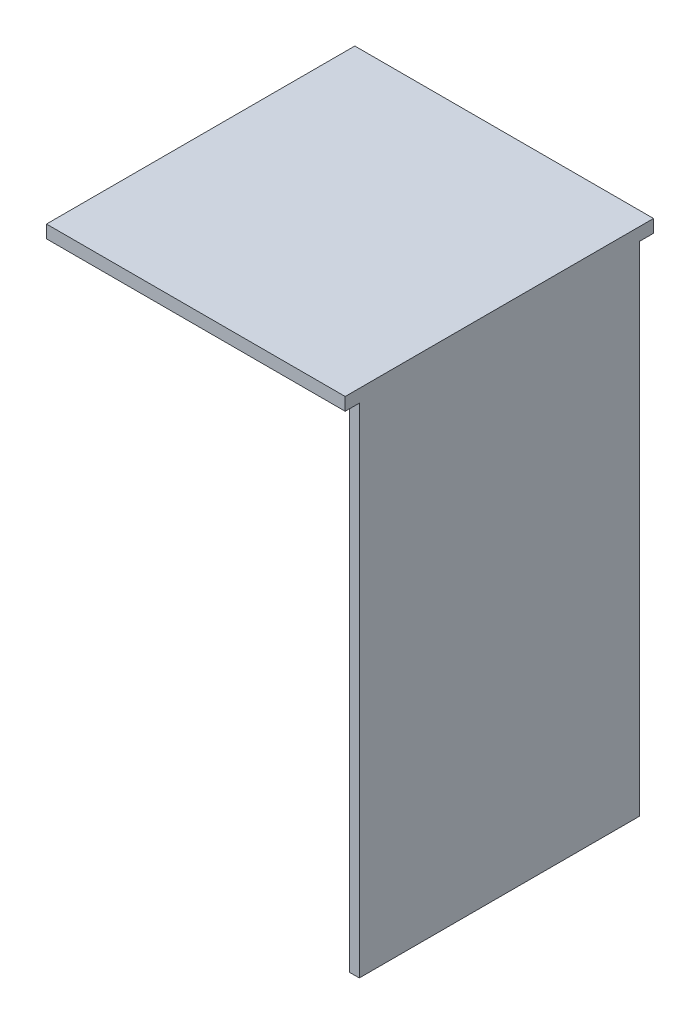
SolidWorks part; units mm, degrees
ref_plane "Front Plane" through (0, 0, 0) normal (0, 0, 1) x (1, 0, 0)
ref_plane "Top Plane" through (0, 0, 0) normal (0, 1, 0) x (1, 0, 0)
ref_plane "Right Plane" through (0, 0, 0) normal (1, 0, 0) x (0, 0, -1)
sketch "Sketch1" plane through (0, 0, 0) normal (0, 1, 0) x (1, 0, 0)
  line L1 (-24, 24) -> (24, 24)
  line L2 (-24, 24) -> (-24, -24)
  line L3 (-24, -24) -> (24, -24)
  line L4 (24, 24) -> (24, -24)
  line L5 (-24, 24) -> (24, -24) construction
  line L6 (-24, -24) -> (24, 24) construction
  point P0 (0, 0)
  dimension "D1" = 48
  dimension "D2" = 48
extrude "Boss-Extrude1" add sketch "Sketch1" along normal blind 2
sketch "Sketch2" plane through (0, 2, 0) normal (0, 1, 0) x (1, 0, 0)
  line L0 (24, -24) -> (24, 24) construction
  line L1 (21, 21.8) -> (22.5, 21.8)
  line L2 (21, 21.8) -> (21, -21.8)
  line L3 (21, -21.8) -> (22.5, -21.8)
  line L4 (22.5, 21.8) -> (22.5, -21.8)
  line L5 (21, 21.8) -> (22.5, -21.8) construction
  line L6 (21, -21.8) -> (22.5, 21.8) construction
  line L7 (24, 24) -> (-24, 24) construction
  line L8 (-24, -24) -> (24, -24) construction
  point P0 (21.75, 0)
  dimension "D1" = 1.5
  dimension "D2" = 1.5
  dimension "D3" = 2.2
  dimension "D4" = 2.2
extrude "Boss-Extrude2" add sketch "Sketch2" against normal blind 79.5
sketch "Sketch3" plane through (0, 0, 0) normal (0, -1, 0) x (1, 0, 0)
  line L0 (-24, 24) -> (24, 24) construction
  line L1 (24, -24) -> (22.5, -24)
  line L2 (24, -24) -> (24, 24)
  line L3 (24, 24) -> (22.5, 24)
  line L4 (22.5, -24) -> (22.5, 24)
  line L5 (22.5, 21.8) -> (22.5, -21.8) construction
extrude "Cut-Extrude1" cut sketch "Sketch3" against normal blind 79.5
